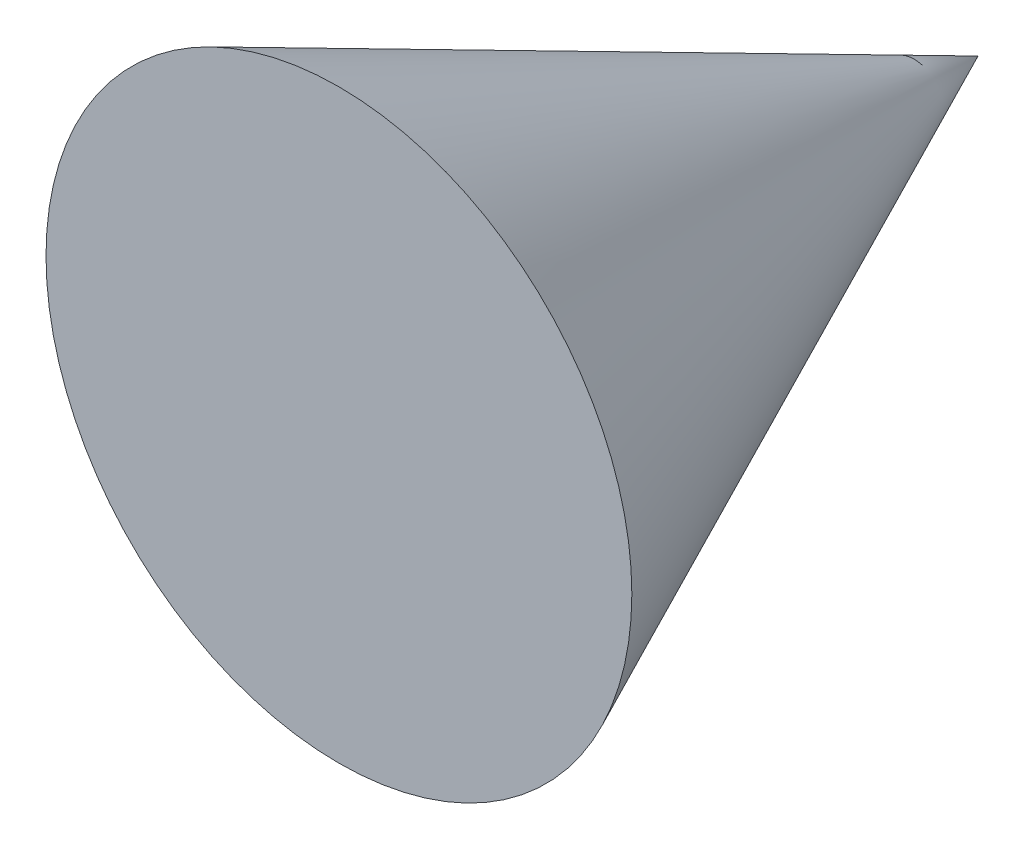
SolidWorks part; units mm, degrees
ref_plane "前视基准面" through (0, 0, 0) normal (0, 0, 1) x (1, 0, 0)
ref_plane "上视基准面" through (0, 0, 0) normal (0, 1, 0) x (1, 0, 0)
ref_plane "右视基准面" through (0, 0, 0) normal (1, 0, 0) x (0, 0, -1)
sketch "草图1" plane through (0, 0, 0) normal (0, 1, 0) x (1, 0, 0)
  line L0 (0, 60.1382) -> (0, -51.5471) construction
  line L1 (0, 45.4132) -> (-25, -9.1303)
  line L2 (-25, -9.1303) -> (0, -9.1303)
  line L3 (0, 45.4132) -> (0, -9.1303)
  dimension "D1" = 60
  dimension "D2" = 25
revolve "旋转1" add sketch "草图1" angle 360 about L0
